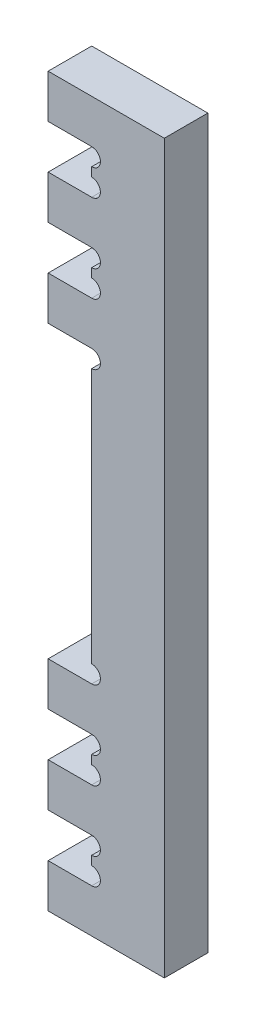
SolidWorks part; units mm, degrees
ref_plane "Ebene vorne" through (0, 0, 0) normal (0, 0, 1) x (1, 0, 0)
ref_plane "Ebene oben" through (0, 0, 0) normal (0, 1, 0) x (1, 0, 0)
ref_plane "Ebene rechts" through (0, 0, 0) normal (1, 0, 0) x (0, 0, -1)
sketch "Skizze1" plane through (0, 0, 0) normal (0, 0, 1) x (1, 0, 0)
  line L0 (0, 0) -> (0, 15)
  line L1 (0, 15) -> (15, 15)
  line L2 (15, 229.45) -> (15, 226.35)
  line L3 (15, 30.1) -> (0, 30.1)
  line L4 (0, 30.1) -> (0, 45.1)
  line L5 (0, 45.1) -> (15, 45.1)
  line L6 (15, 199.35) -> (15, 196.25)
  line L7 (15, 60.2) -> (0, 60.2)
  line L8 (0, 60.2) -> (0, 75.2)
  line L9 (0, 75.2) -> (15, 75.2)
  line L10 (15, 169.25) -> (15, 81.2)
  line L11 (0, 0) -> (40, 0)
  line L12 (15, 175.25) -> (0, 175.25)
  line L13 (0, 175.25) -> (0, 190.25)
  line L14 (0, 190.25) -> (15, 190.25)
  line L15 (15, 54.2) -> (15, 51.1)
  line L16 (15, 205.35) -> (0, 205.35)
  line L17 (0, 205.35) -> (0, 220.35)
  line L18 (0, 220.35) -> (15, 220.35)
  line L19 (15, 24.1) -> (15, 21)
  line L20 (15, 235.45) -> (0, 235.45)
  line L21 (0, 235.45) -> (0, 250.45)
  line L22 (0, 250.45) -> (40, 250.45)
  line L23 (40, 250.45) -> (40, 0)
  arc A0 (15, 235.45) -> (15, 229.45) centre (15, 232.45) cw
  arc A1 (15, 226.35) -> (15, 220.35) centre (15, 223.35) cw
  arc A2 (15, 205.35) -> (15, 199.35) centre (15, 202.35) cw
  arc A3 (15, 196.25) -> (15, 190.25) centre (15, 193.25) cw
  arc A4 (15, 175.25) -> (15, 169.25) centre (15, 172.25) cw
  arc A5 (15, 81.2) -> (15, 75.2) centre (15, 78.2) cw
  arc A6 (15, 60.2) -> (15, 54.2) centre (15, 57.2) cw
  arc A7 (15, 51.1) -> (15, 45.1) centre (15, 48.1) cw
  arc A8 (15, 30.1) -> (15, 24.1) centre (15, 27.1) cw
  arc A9 (15, 21) -> (15, 15) centre (15, 18) cw
  dimension "D1" = 100.05
  dimension "D2" = 15
  dimension "D3" = 15.1
  dimension "D4" = 15
  dimension "D5" = 15.1
  dimension "D6" = 15
  dimension "D7" = 15
  dimension "D8" = 15.1
  dimension "D9" = 15
  dimension "D10" = 15.1
  dimension "D11" = 15
  dimension "D12" = 40
  dimension "D13" = 15
  dimension "D14" = 6
  dimension "D15" = 6
  dimension "D16" = 6
  dimension "D17" = 6
  dimension "D18" = 6
  dimension "D19" = 6
  dimension "D20" = 6
  dimension "D21" = 6
  dimension "D22" = 6
  dimension "D23" = 6
extrude "Aufsatz-Linear austragen1" add sketch "Skizze1" along normal blind 15 contours L10 A5 L9 L8 L7 A6 L15 A7 L5 L4 L3 A8 L19 A9 L1 L0 L11 L23 L22 L21 L20 A0 L2 A1 L18 L17 L16 A2 L6 A3 L14 L13 L12 A4
